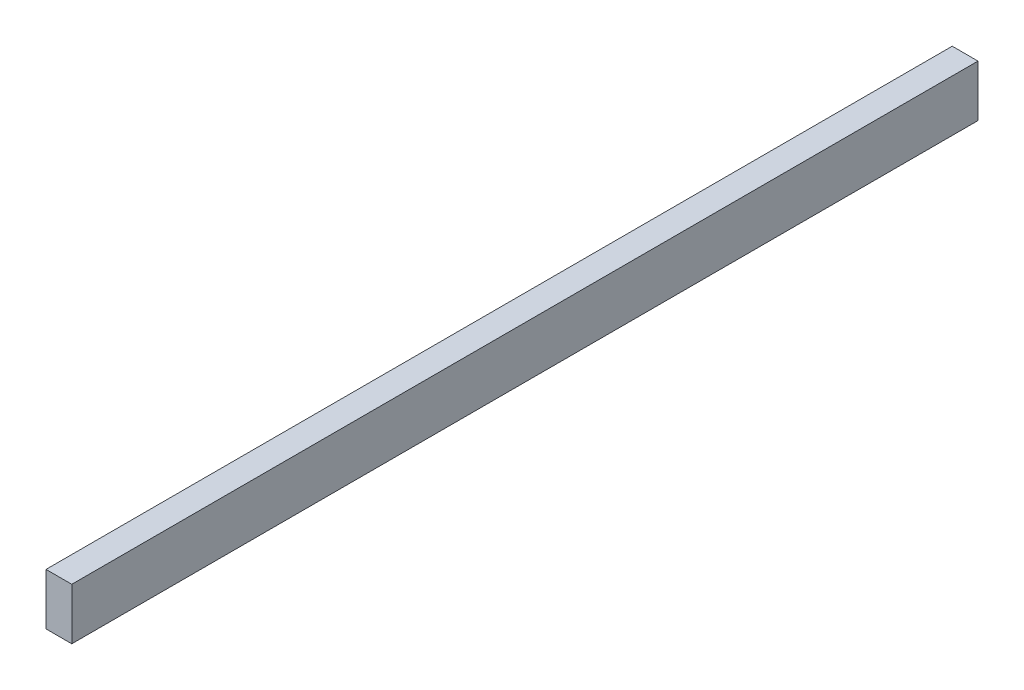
SolidWorks part; units mm, degrees
ref_plane "Face" through (0, 0, 0) normal (0, 0, 1) x (1, 0, 0)
ref_plane "Dessus" through (0, 0, 0) normal (0, 1, 0) x (1, 0, 0)
ref_plane "Droite" through (0, 0, 0) normal (1, 0, 0) x (0, 0, -1)
sketch "Esquisse1" plane through (0, 0, 0) normal (0, 0, 1) x (1, 0, 0)
  line L1 (0, 0) -> (5, 0)
  line L2 (0, 0) -> (0, 10)
  line L3 (0, 10) -> (5, 10)
  line L4 (5, 0) -> (5, 10)
  dimension "D1" = 5
  dimension "D2" = 10
extrude "Extrusion1" add sketch "Esquisse1" along normal blind 175.77
